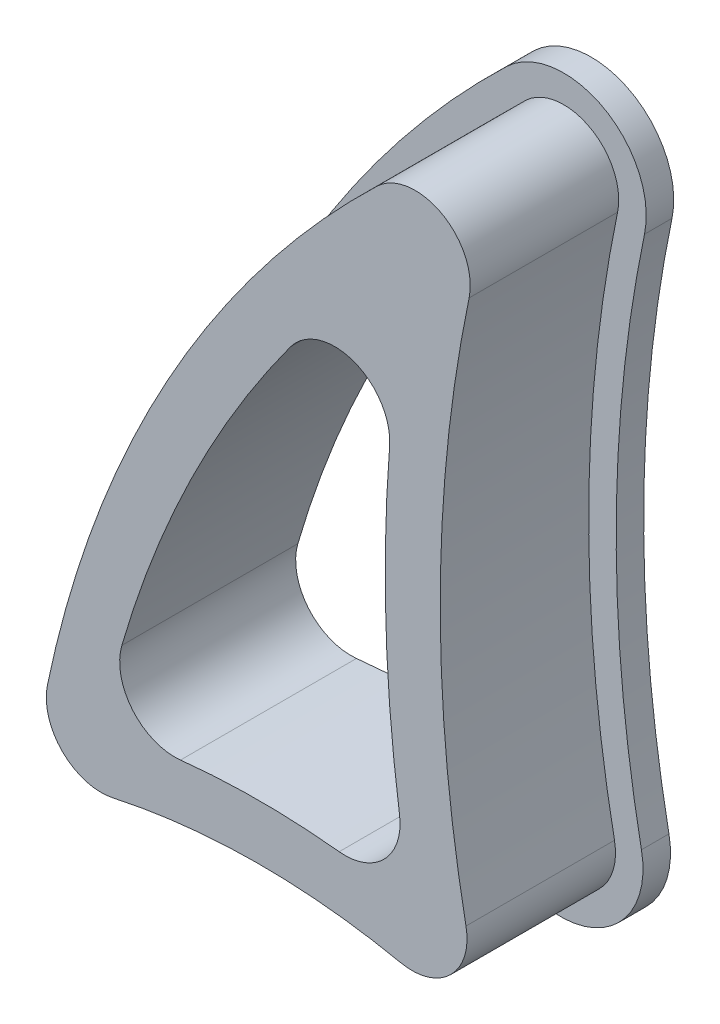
SolidWorks part; units mm, degrees
ref_plane "前视基准面" through (0, 0, 0) normal (0, 0, 1) x (1, 0, 0)
ref_plane "上视基准面" through (0, 0, 0) normal (0, 1, 0) x (1, 0, 0)
ref_plane "右视基准面" through (0, 0, 0) normal (1, 0, 0) x (0, 0, -1)
other "Configuration Table"
imported_body "基体零件-Part11-Support right-1"
ref_plane "基准面1" through (0, 0, 0) normal (1, 0, 0) x (0, 0, -1)
mirror "镜向2" about plane through (0, 0, 0) normal (1, 0, 0)
delete or keep bodies "实体-删除/保留 1" type delete bodies bodies 106
